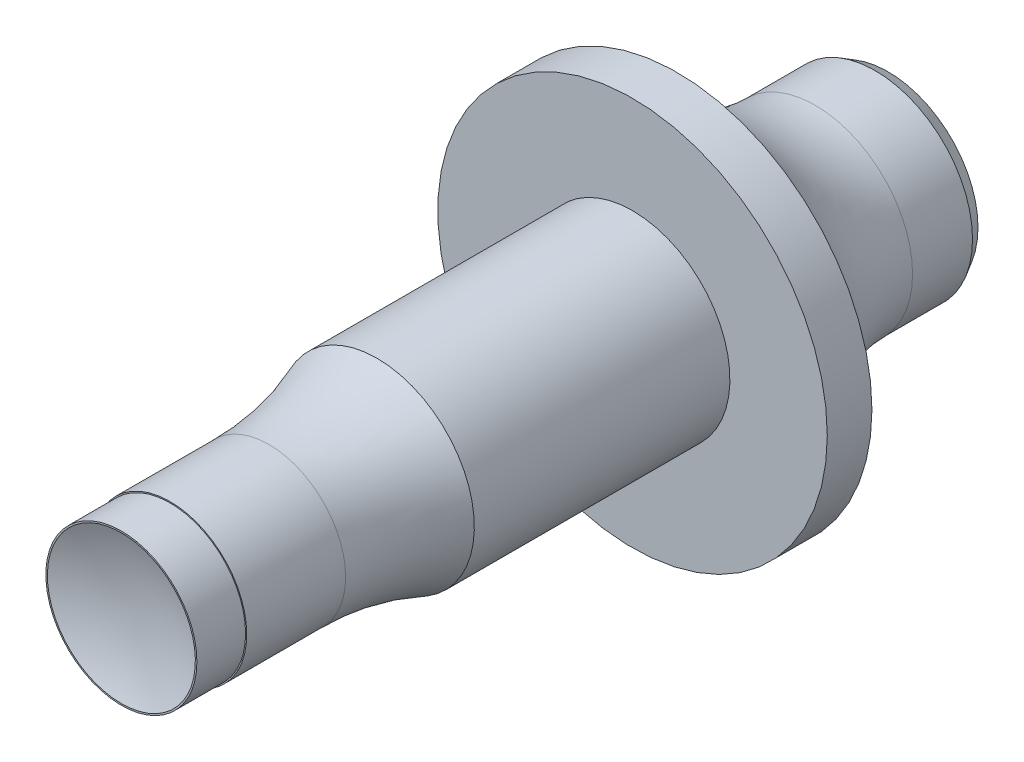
SolidWorks part; units mm, degrees
ref_plane "Front Plane" through (0, 0, 0) normal (0, 0, 1) x (1, 0, 0)
ref_plane "Top Plane" through (0, 0, 0) normal (0, 1, 0) x (1, 0, 0)
ref_plane "Right Plane" through (0, 0, 0) normal (1, 0, 0) x (0, 0, -1)
sketch "Sketch1" plane through (0, 0, 0) normal (0, 0, 1) x (1, 0, 0)
  circle A0 centre (0, 0) radius 12.7
  dimension "D1" = 25.4
extrude "Boss-Extrude1" add sketch "Sketch1" against normal blind 100
sketch "Sketch2" plane through (0, 0, 0) normal (0, 0, 1) x (1, 0, 0)
  circle A0 centre (0, 0) radius 10
  dimension "D1" = 20
extrude "Cut-Extrude1" cut sketch "Sketch2" against normal blind 33.3333 flip side to cut
sketch "Sketch3" plane through (0, 0, 0) normal (0, 0, 1) x (1, 0, 0)
  circle A0 centre (0, 0) radius 9.85
  dimension "D1" = 19.7
extrude "Cut-Extrude2" cut sketch "Sketch3" against normal blind 6.35 flip side to cut
sketch "Sketch4" plane through (0, 0, 0) normal (1, 0, 0) x (0, 0, -1)
  line L0 (0, 0) -> (0, 9.65)
  line L1 (0, 9.85) -> (0, -9.85) construction
  line L2 (1.9045, 0) -> (1.9045, 9.65) construction
  line L3 (0, 0) -> (1.9045, 0)
  line L4 (0, 0) -> (0, -9.65) construction
  arc A0 (1.9045, 0) -> (0, 9.65) centre (-23.4955, 0) ccw
  dimension "D2" = 25.4
  dimension "D1" = 19.3
revolve "Cut-Revolve1" cut sketch "Sketch4" angle 360 about L3
chamfer "Chamfer1" distance 1.6933 angle 30 1 edges at (12.7, 0, -100)
sketch "Sketch5" plane through (0, 0, 0) normal (1, 0, 0) x (0, 0, -1)
  line L0 (33.3333, 0) -> (19.2461, 0)
  line L1 (33.3333, 12.7) -> (33.3333, -12.7) construction
  line L2 (19.2461, 0) -> (19.2461, 10)
  line L3 (33.3333, 10) -> (6.35, 10) construction
  line L4 (33.3333, 12.7) -> (33.3333, 0)
  line L5 (19.2461, 10) -> (33.3333, 10) construction
  arc A0 (19.2461, 10) -> (33.3333, 12.7) centre (19.2461, 48.1) ccw
  dimension "D1" = 38.1
revolve "Revolve1" add sketch "Sketch5" angle 360 about L0
sketch "Sketch6" plane through (0, 0, 0) normal (1, 0, 0) x (0, 0, -1)
  line L0 (66.6667, 0) -> (90.4867, 0)
  line L1 (66.6667, 0) -> (66.6667, 25.4)
  line L2 (66.6667, 25.4) -> (72.4908, 25.4)
  line L3 (90.4867, 0) -> (90.4867, 12.7)
  line L4 (98.3067, 12.7) -> (33.3333, 12.7) construction
  line L5 (90.4867, 12.7) -> (66.6667, 12.7) construction
  line L6 (100, -12.7) -> (100, 12.7) construction
  arc A0 (90.4867, 12.7) -> (72.4908, 25.4) centre (90.4867, 31.8) cw
  dimension "D2" = 19.1
  dimension "D1" = 33.3333
  dimension "D3" = 23.82
revolve "Revolve2" add sketch "Sketch6" angle 360 about L0
sketch "Sketch7" plane through (0, 0, -100) normal (0, 0, -1) x (-1, 0, 0)
  line L9 (-21.4951, 4.8864) -> (-11.7224, 4.8864)
  line L10 (-21.4951, 4.8864) -> (-21.4951, -4.8864)
  line L11 (-21.4951, -4.8864) -> (-11.7224, -4.8864)
  line L12 (-11.7224, 4.8864) -> (-11.7224, -4.8864)
  circle A5 centre (0, 0) radius 12.7 construction
  circle A6 centre (0, 0) radius 11.7224 construction
  point P8 (-11.7224, 0)
extrude "Cut-Extrude3" [suppressed] cut sketch "Sketch7" against normal through all
